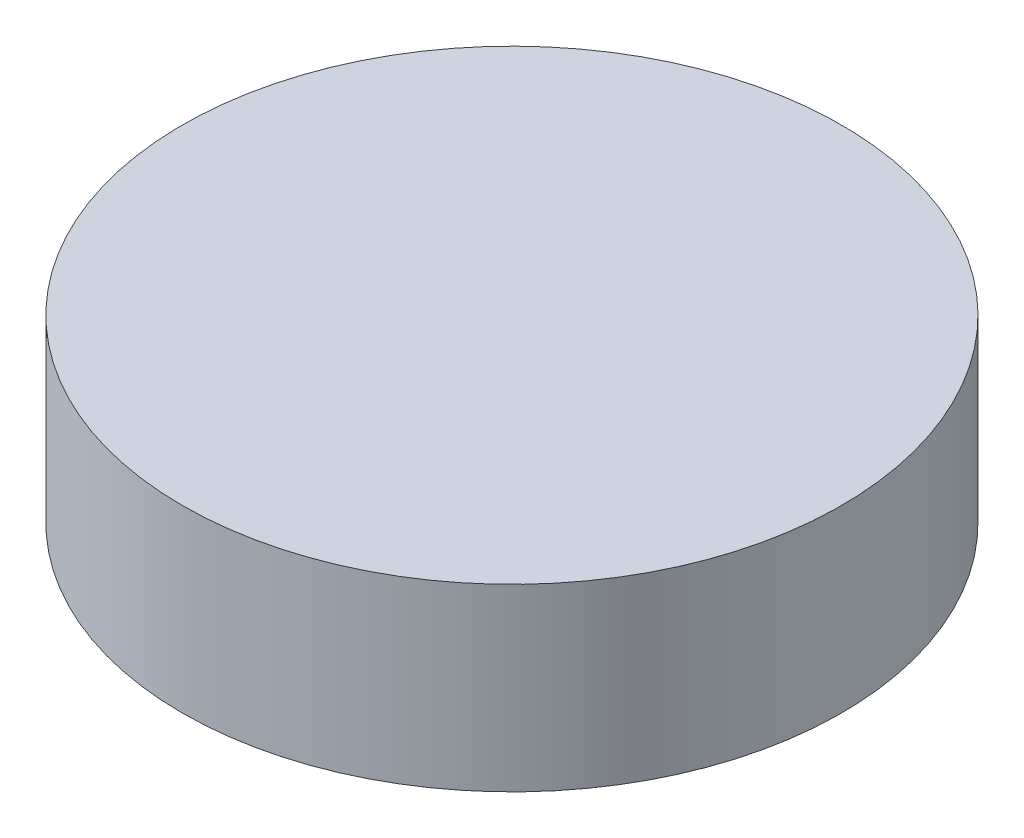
SolidWorks part; units mm, degrees
ref_plane "Front Plane" through (0, 0, 0) normal (0, 0, 1) x (1, 0, 0)
ref_plane "Top Plane" through (0, 0, 0) normal (0, 1, 0) x (1, 0, 0)
ref_plane "Right Plane" through (0, 0, 0) normal (1, 0, 0) x (0, 0, -1)
sketch "Sketch1" plane through (0, 0, 0) normal (0, 1, 0) x (1, 0, 0)
  circle A0 centre (0, 0) radius 34.925
  dimension "D1" = 69.85
extrude "Boss-Extrude1" add sketch "Sketch1" against normal blind 19.05
